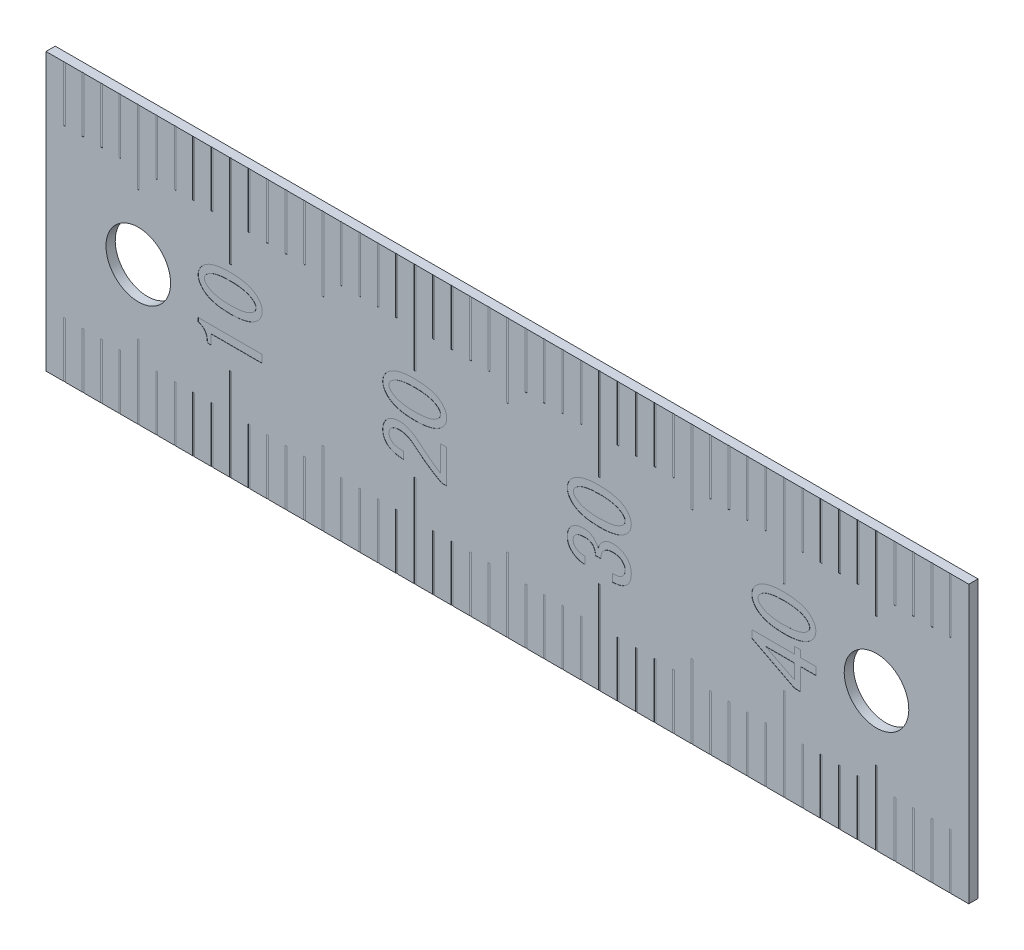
SolidWorks part; units mm, degrees
ref_plane "Front" through (0, 0, 0) normal (0, 0, 1) x (1, 0, 0)
ref_plane "Top" through (0, 0, 0) normal (0, 1, 0) x (1, 0, 0)
ref_plane "Right" through (0, 0, 0) normal (1, 0, 0) x (0, 0, -1)
sketch "Sketch1" plane through (0, 0, 0) normal (0, 0, 1) x (1, 0, 0)
  line L1 (0, 0) -> (0, 50)
  line L2 (0, 0) -> (15, 0)
  line L3 (15, 0) -> (15, 50)
  line L4 (0, 50) -> (15, 50)
  dimension "D1" = 50
  dimension "D2" = 15
extrude "Extrude1" add sketch "Sketch1" along normal blind 0.5
sketch "Sketch2" plane through (0, 0, 0.5) normal (0, 0, 1) x (1, 0, 0)
  line L0 (0, 50) -> (0, 0) construction
  line L1 (0, 0) -> (15, 0) construction
  line L2 (15, 50) -> (0, 50) construction
  circle A0 centre (7.5, 5) radius 1.75
  circle A1 centre (7.5, 45) radius 1.75
  dimension "D1" = 7.5
  dimension "D2" = 7.5
  dimension "D3" = 5
  dimension "D4" = 5
  dimension "D5" = 3.5
  dimension "D6" = 3.5
extrude "Extrude2" cut sketch "Sketch2" against normal through all
sketch "Sketch3" plane through (0, 0, 0.5) normal (0, 0, 1) x (1, 0, 0)
  line L0 (15, 50) -> (0, 50) construction
  line L1 (5.25, 28.25) -> (9.75, 28.25) construction
  line L2 (5.25, 18.25) -> (9.75, 18.25) construction
  line L3 (5.25, 8.25) -> (9.75, 8.25) construction
  line L5 (0, 50) -> (0, 0) construction
  line L7 (5.25, 38.25) -> (9.75, 38.25) construction
  line L8 (5.25, 38.25) -> (5.25, 41.75) construction
  line L9 (7.5, 0) -> (7.5, 50) construction
  line L10 (0, 0) -> (15, 0) construction
  line L11 (0, 40) -> (15, 40) construction
  line L12 (15, 0) -> (15, 50) construction
  line L13 (5.25, 41.75) -> (9.75, 41.75) construction
  line L14 (9.75, 38.25) -> (9.75, 41.75) construction
  line L15 (5.25, 38.25) -> (9.75, 41.75) construction
  line L16 (5.25, 41.75) -> (9.75, 38.25) construction
  circle A0 centre (7.5, 45) radius 1.75 construction
  text T0 "10" font "ＭＳ ゴシック" height 3.5
  text T1 "20" font "ＭＳ ゴシック" height 3.5
  text T2 "30" font "ＭＳ ゴシック" height 3.5
  text T3 "40" font "ＭＳ ゴシック" height 3.5
  point P7 (7.5, 40)
  dimension "D2" = 7.5
  dimension "D1" = 4
  dimension "D6" = 10
  dimension "D5" = 4.5
  dimension "D7" = 3.5
extrude "Extrude3" cut sketch "Sketch3" against normal blind 0.01
sketch "Sketch4" plane through (0, 0, 0.5) normal (0, 0, 1) x (1, 0, 0)
  line L0 (15, 40.05) -> (10, 40.05)
  line L1 (15, 0) -> (15, 50) construction
  line L2 (10, 40.05) -> (10, 39.95)
  line L3 (10, 39.95) -> (15, 39.95)
  line L4 (15, 39.95) -> (15, 40.05)
  line L5 (15, 50) -> (0, 50) construction
  line L6 (15, 48.05) -> (15, 47.95)
  line L7 (15, 44.95) -> (11, 44.95)
  line L8 (15, 44.95) -> (15, 45.05)
  line L9 (15, 45.05) -> (11, 45.05)
  line L10 (11, 44.95) -> (11, 45.05)
  line L11 (15, 49.05) -> (12, 49.05)
  line L12 (15, 49.05) -> (15, 48.95)
  line L13 (15, 48.95) -> (12, 48.95)
  line L14 (12, 49.05) -> (12, 48.95)
  line L15 (15, 48.05) -> (12, 48.05)
  line L16 (15, 47.95) -> (12, 47.95)
  line L17 (12, 48.05) -> (12, 47.95)
  line L18 (15, 47.05) -> (15, 46.95)
  line L19 (15, 47.05) -> (12, 47.05)
  line L20 (15, 46.95) -> (12, 46.95)
  line L21 (12, 47.05) -> (12, 46.95)
  line L22 (15, 46.05) -> (15, 45.95)
  line L23 (15, 46.05) -> (12, 46.05)
  line L24 (15, 45.95) -> (12, 45.95)
  line L25 (12, 46.05) -> (12, 45.95)
  line L26 (15, 30.05) -> (10, 30.05)
  line L27 (10, 30.05) -> (10, 29.95)
  line L28 (10, 29.95) -> (15, 29.95)
  line L29 (15, 29.95) -> (15, 30.05)
  line L30 (15, 44.05) -> (15, 43.95)
  line L31 (15, 44.05) -> (12, 44.05)
  line L32 (15, 43.95) -> (12, 43.95)
  line L33 (12, 44.05) -> (12, 43.95)
  line L34 (15, 43.05) -> (15, 42.95)
  line L35 (15, 43.05) -> (12, 43.05)
  line L36 (15, 42.95) -> (12, 42.95)
  line L37 (12, 43.05) -> (12, 42.95)
  line L38 (15, 42.05) -> (15, 41.95)
  line L39 (15, 42.05) -> (12, 42.05)
  line L40 (15, 41.95) -> (12, 41.95)
  line L41 (12, 42.05) -> (12, 41.95)
  line L42 (15, 41.05) -> (15, 40.95)
  line L43 (15, 41.05) -> (12, 41.05)
  line L44 (15, 40.95) -> (12, 40.95)
  line L45 (12, 41.05) -> (12, 40.95)
  line L46 (12, 45.05) -> (12, 44.95)
  line L47 (15, 45.05) -> (12, 45.05)
  line L48 (15, 44.95) -> (12, 44.95)
  line L49 (15, 45.05) -> (15, 44.95)
  line L50 (15, 38.05) -> (15, 37.95)
  line L51 (15, 34.95) -> (11, 34.95)
  line L52 (15, 34.95) -> (15, 35.05)
  line L53 (15, 35.05) -> (11, 35.05)
  line L54 (11, 34.95) -> (11, 35.05)
  line L55 (15, 39.05) -> (12, 39.05)
  line L56 (15, 39.05) -> (15, 38.95)
  line L57 (15, 38.95) -> (12, 38.95)
  line L58 (12, 39.05) -> (12, 38.95)
  line L59 (15, 38.05) -> (12, 38.05)
  line L60 (15, 37.95) -> (12, 37.95)
  line L61 (12, 38.05) -> (12, 37.95)
  line L62 (15, 37.05) -> (15, 36.95)
  line L63 (15, 37.05) -> (12, 37.05)
  line L64 (15, 36.95) -> (12, 36.95)
  line L65 (12, 37.05) -> (12, 36.95)
  line L66 (15, 36.05) -> (15, 35.95)
  line L67 (15, 36.05) -> (12, 36.05)
  line L68 (15, 35.95) -> (12, 35.95)
  line L69 (12, 36.05) -> (12, 35.95)
  line L70 (15, 34.05) -> (15, 33.95)
  line L71 (15, 34.05) -> (12, 34.05)
  line L72 (15, 33.95) -> (12, 33.95)
  line L73 (12, 34.05) -> (12, 33.95)
  line L74 (15, 33.05) -> (15, 32.95)
  line L75 (15, 33.05) -> (12, 33.05)
  line L76 (15, 32.95) -> (12, 32.95)
  line L77 (12, 33.05) -> (12, 32.95)
  line L78 (15, 32.05) -> (15, 31.95)
  line L79 (15, 32.05) -> (12, 32.05)
  line L80 (15, 31.95) -> (12, 31.95)
  line L81 (12, 32.05) -> (12, 31.95)
  line L82 (15, 31.05) -> (15, 30.95)
  line L83 (15, 31.05) -> (12, 31.05)
  line L84 (15, 30.95) -> (12, 30.95)
  line L85 (12, 31.05) -> (12, 30.95)
  line L86 (15, 20.05) -> (10, 20.05)
  line L87 (10, 20.05) -> (10, 19.95)
  line L88 (10, 19.95) -> (15, 19.95)
  line L89 (15, 19.95) -> (15, 20.05)
  line L90 (15, 28.05) -> (15, 27.95)
  line L91 (15, 24.95) -> (11, 24.95)
  line L92 (15, 24.95) -> (15, 25.05)
  line L93 (15, 25.05) -> (11, 25.05)
  line L94 (11, 24.95) -> (11, 25.05)
  line L95 (15, 29.05) -> (12, 29.05)
  line L96 (15, 29.05) -> (15, 28.95)
  line L97 (15, 28.95) -> (12, 28.95)
  line L98 (12, 29.05) -> (12, 28.95)
  line L99 (15, 28.05) -> (12, 28.05)
  line L100 (15, 27.95) -> (12, 27.95)
  line L101 (12, 28.05) -> (12, 27.95)
  line L102 (15, 27.05) -> (15, 26.95)
  line L103 (15, 27.05) -> (12, 27.05)
  line L104 (15, 26.95) -> (12, 26.95)
  line L105 (12, 27.05) -> (12, 26.95)
  line L106 (15, 26.05) -> (15, 25.95)
  line L107 (15, 26.05) -> (12, 26.05)
  line L108 (15, 25.95) -> (12, 25.95)
  line L109 (12, 26.05) -> (12, 25.95)
  line L110 (15, 24.05) -> (15, 23.95)
  line L111 (15, 24.05) -> (12, 24.05)
  line L112 (15, 23.95) -> (12, 23.95)
  line L113 (12, 24.05) -> (12, 23.95)
  line L114 (15, 23.05) -> (15, 22.95)
  line L115 (15, 23.05) -> (12, 23.05)
  line L116 (15, 22.95) -> (12, 22.95)
  line L117 (12, 23.05) -> (12, 22.95)
  line L118 (15, 22.05) -> (15, 21.95)
  line L119 (15, 22.05) -> (12, 22.05)
  line L120 (15, 21.95) -> (12, 21.95)
  line L121 (12, 22.05) -> (12, 21.95)
  line L122 (15, 21.05) -> (15, 20.95)
  line L123 (15, 21.05) -> (12, 21.05)
  line L124 (15, 20.95) -> (12, 20.95)
  line L125 (12, 21.05) -> (12, 20.95)
  line L126 (15, 10.05) -> (10, 10.05)
  line L127 (10, 10.05) -> (10, 9.95)
  line L128 (10, 9.95) -> (15, 9.95)
  line L129 (15, 9.95) -> (15, 10.05)
  line L130 (15, 18.05) -> (15, 17.95)
  line L131 (15, 14.95) -> (11, 14.95)
  line L132 (15, 14.95) -> (15, 15.05)
  line L133 (15, 15.05) -> (11, 15.05)
  line L134 (11, 14.95) -> (11, 15.05)
  line L135 (15, 19.05) -> (12, 19.05)
  line L136 (15, 19.05) -> (15, 18.95)
  line L137 (15, 18.95) -> (12, 18.95)
  line L138 (12, 19.05) -> (12, 18.95)
  line L139 (15, 18.05) -> (12, 18.05)
  line L140 (15, 17.95) -> (12, 17.95)
  line L141 (12, 18.05) -> (12, 17.95)
  line L142 (15, 17.05) -> (15, 16.95)
  line L143 (15, 17.05) -> (12, 17.05)
  line L144 (15, 16.95) -> (12, 16.95)
  line L145 (12, 17.05) -> (12, 16.95)
  line L146 (15, 16.05) -> (15, 15.95)
  line L147 (15, 16.05) -> (12, 16.05)
  line L148 (15, 15.95) -> (12, 15.95)
  line L149 (12, 16.05) -> (12, 15.95)
  line L150 (15, 14.05) -> (15, 13.95)
  line L151 (15, 14.05) -> (12, 14.05)
  line L152 (15, 13.95) -> (12, 13.95)
  line L153 (12, 14.05) -> (12, 13.95)
  line L154 (15, 13.05) -> (15, 12.95)
  line L155 (15, 13.05) -> (12, 13.05)
  line L156 (15, 12.95) -> (12, 12.95)
  line L157 (12, 13.05) -> (12, 12.95)
  line L158 (15, 12.05) -> (15, 11.95)
  line L159 (15, 12.05) -> (12, 12.05)
  line L160 (15, 11.95) -> (12, 11.95)
  line L161 (12, 12.05) -> (12, 11.95)
  line L162 (15, 11.05) -> (15, 10.95)
  line L163 (15, 11.05) -> (12, 11.05)
  line L164 (15, 10.95) -> (12, 10.95)
  line L165 (12, 11.05) -> (12, 10.95)
  line L166 (7.5, 50) -> (7.5, 36.693) construction
  line L167 (3, 1.05) -> (3, 0.95)
  line L168 (0, 0.95) -> (3, 0.95)
  line L169 (0, 1.05) -> (3, 1.05)
  line L170 (15, 8.05) -> (15, 7.95)
  line L171 (15, 4.95) -> (11, 4.95)
  line L172 (15, 4.95) -> (15, 5.05)
  line L173 (15, 5.05) -> (11, 5.05)
  line L174 (11, 4.95) -> (11, 5.05)
  line L175 (15, 9.05) -> (12, 9.05)
  line L176 (15, 9.05) -> (15, 8.95)
  line L177 (15, 8.95) -> (12, 8.95)
  line L178 (12, 9.05) -> (12, 8.95)
  line L179 (15, 8.05) -> (12, 8.05)
  line L180 (15, 7.95) -> (12, 7.95)
  line L181 (12, 8.05) -> (12, 7.95)
  line L182 (15, 7.05) -> (15, 6.95)
  line L183 (15, 7.05) -> (12, 7.05)
  line L184 (15, 6.95) -> (12, 6.95)
  line L185 (12, 7.05) -> (12, 6.95)
  line L186 (15, 6.05) -> (15, 5.95)
  line L187 (15, 6.05) -> (12, 6.05)
  line L188 (15, 5.95) -> (12, 5.95)
  line L189 (12, 6.05) -> (12, 5.95)
  line L190 (15, 4.05) -> (15, 3.95)
  line L191 (15, 4.05) -> (12, 4.05)
  line L192 (15, 3.95) -> (12, 3.95)
  line L193 (12, 4.05) -> (12, 3.95)
  line L194 (15, 3.05) -> (15, 2.95)
  line L195 (15, 3.05) -> (12, 3.05)
  line L196 (15, 2.95) -> (12, 2.95)
  line L197 (12, 3.05) -> (12, 2.95)
  line L198 (15, 2.05) -> (15, 1.95)
  line L199 (15, 2.05) -> (12, 2.05)
  line L200 (15, 1.95) -> (12, 1.95)
  line L201 (12, 2.05) -> (12, 1.95)
  line L202 (15, 1.05) -> (15, 0.95)
  line L203 (15, 1.05) -> (12, 1.05)
  line L204 (15, 0.95) -> (12, 0.95)
  line L205 (12, 1.05) -> (12, 0.95)
  line L206 (15, 0.05) -> (10, 0.05)
  line L207 (10, 0.05) -> (10, -0.05)
  line L208 (10, -0.05) -> (15, -0.05)
  line L209 (15, -0.05) -> (15, 0.05)
  line L210 (0, 1.05) -> (0, 0.95)
  line L211 (3, 2.05) -> (3, 1.95)
  line L212 (0, 1.95) -> (3, 1.95)
  line L213 (0, 2.05) -> (3, 2.05)
  line L214 (0, 2.05) -> (0, 1.95)
  line L215 (3, 3.05) -> (3, 2.95)
  line L216 (0, 2.95) -> (3, 2.95)
  line L217 (0, 3.05) -> (3, 3.05)
  line L218 (0, 3.05) -> (0, 2.95)
  line L219 (3, 4.05) -> (3, 3.95)
  line L220 (0, 3.95) -> (3, 3.95)
  line L221 (0, 4.05) -> (3, 4.05)
  line L222 (0, 4.05) -> (0, 3.95)
  line L223 (3, 6.05) -> (3, 5.95)
  line L224 (0, 5.95) -> (3, 5.95)
  line L225 (0, 6.05) -> (3, 6.05)
  line L226 (0, 6.05) -> (0, 5.95)
  line L227 (3, 7.05) -> (3, 6.95)
  line L228 (0, 6.95) -> (3, 6.95)
  line L229 (0, 7.05) -> (3, 7.05)
  line L230 (0, 7.05) -> (0, 6.95)
  line L231 (3, 8.05) -> (3, 7.95)
  line L232 (0, 7.95) -> (3, 7.95)
  line L233 (0, 8.05) -> (3, 8.05)
  line L234 (3, 9.05) -> (3, 8.95)
  line L235 (0, 8.95) -> (3, 8.95)
  line L236 (0, 9.05) -> (0, 8.95)
  line L237 (0, 9.05) -> (3, 9.05)
  line L238 (4, 4.95) -> (4, 5.05)
  line L239 (0, 5.05) -> (4, 5.05)
  line L240 (0, 4.95) -> (0, 5.05)
  line L241 (0, 4.95) -> (4, 4.95)
  line L242 (0, 8.05) -> (0, 7.95)
  line L243 (3, 11.05) -> (3, 10.95)
  line L244 (0, 10.95) -> (3, 10.95)
  line L245 (0, 11.05) -> (3, 11.05)
  line L246 (0, 11.05) -> (0, 10.95)
  line L247 (3, 12.05) -> (3, 11.95)
  line L248 (0, 11.95) -> (3, 11.95)
  line L249 (0, 12.05) -> (3, 12.05)
  line L250 (0, 12.05) -> (0, 11.95)
  line L251 (3, 13.05) -> (3, 12.95)
  line L252 (0, 12.95) -> (3, 12.95)
  line L253 (0, 13.05) -> (3, 13.05)
  line L254 (0, 13.05) -> (0, 12.95)
  line L255 (3, 14.05) -> (3, 13.95)
  line L256 (0, 13.95) -> (3, 13.95)
  line L257 (0, 14.05) -> (3, 14.05)
  line L258 (0, 14.05) -> (0, 13.95)
  line L259 (3, 16.05) -> (3, 15.95)
  line L260 (0, 15.95) -> (3, 15.95)
  line L261 (0, 16.05) -> (3, 16.05)
  line L262 (0, 16.05) -> (0, 15.95)
  line L263 (3, 17.05) -> (3, 16.95)
  line L264 (0, 16.95) -> (3, 16.95)
  line L265 (0, 17.05) -> (3, 17.05)
  line L266 (0, 17.05) -> (0, 16.95)
  line L267 (3, 18.05) -> (3, 17.95)
  line L268 (0, 17.95) -> (3, 17.95)
  line L269 (0, 18.05) -> (3, 18.05)
  line L270 (3, 19.05) -> (3, 18.95)
  line L271 (0, 18.95) -> (3, 18.95)
  line L272 (0, 19.05) -> (0, 18.95)
  line L273 (0, 19.05) -> (3, 19.05)
  line L274 (4, 14.95) -> (4, 15.05)
  line L275 (0, 15.05) -> (4, 15.05)
  line L276 (0, 14.95) -> (0, 15.05)
  line L277 (0, 14.95) -> (4, 14.95)
  line L278 (0, 18.05) -> (0, 17.95)
  line L279 (0, 9.95) -> (0, 10.05)
  line L280 (5, 9.95) -> (0, 9.95)
  line L281 (5, 10.05) -> (5, 9.95)
  line L282 (0, 10.05) -> (5, 10.05)
  line L283 (3, 21.05) -> (3, 20.95)
  line L284 (0, 20.95) -> (3, 20.95)
  line L285 (0, 21.05) -> (3, 21.05)
  line L286 (0, 21.05) -> (0, 20.95)
  line L287 (3, 22.05) -> (3, 21.95)
  line L288 (0, 21.95) -> (3, 21.95)
  line L289 (0, 22.05) -> (3, 22.05)
  line L290 (0, 22.05) -> (0, 21.95)
  line L291 (3, 23.05) -> (3, 22.95)
  line L292 (0, 22.95) -> (3, 22.95)
  line L293 (0, 23.05) -> (3, 23.05)
  line L294 (0, 23.05) -> (0, 22.95)
  line L295 (3, 24.05) -> (3, 23.95)
  line L296 (0, 23.95) -> (3, 23.95)
  line L297 (0, 24.05) -> (3, 24.05)
  line L298 (0, 24.05) -> (0, 23.95)
  line L299 (3, 26.05) -> (3, 25.95)
  line L300 (0, 25.95) -> (3, 25.95)
  line L301 (0, 26.05) -> (3, 26.05)
  line L302 (0, 26.05) -> (0, 25.95)
  line L303 (3, 27.05) -> (3, 26.95)
  line L304 (0, 26.95) -> (3, 26.95)
  line L305 (0, 27.05) -> (3, 27.05)
  line L306 (0, 27.05) -> (0, 26.95)
  line L307 (3, 28.05) -> (3, 27.95)
  line L308 (0, 27.95) -> (3, 27.95)
  line L309 (0, 28.05) -> (3, 28.05)
  line L310 (3, 29.05) -> (3, 28.95)
  line L311 (0, 28.95) -> (3, 28.95)
  line L312 (0, 29.05) -> (0, 28.95)
  line L313 (0, 29.05) -> (3, 29.05)
  line L314 (4, 24.95) -> (4, 25.05)
  line L315 (0, 25.05) -> (4, 25.05)
  line L316 (0, 24.95) -> (0, 25.05)
  line L317 (0, 24.95) -> (4, 24.95)
  line L318 (0, 28.05) -> (0, 27.95)
  line L319 (0, 19.95) -> (0, 20.05)
  line L320 (5, 19.95) -> (0, 19.95)
  line L321 (5, 20.05) -> (5, 19.95)
  line L322 (0, 20.05) -> (5, 20.05)
  line L323 (3, 31.05) -> (3, 30.95)
  line L324 (0, 30.95) -> (3, 30.95)
  line L325 (0, 31.05) -> (3, 31.05)
  line L326 (0, 31.05) -> (0, 30.95)
  line L327 (3, 32.05) -> (3, 31.95)
  line L328 (0, 31.95) -> (3, 31.95)
  line L329 (0, 32.05) -> (3, 32.05)
  line L330 (0, 32.05) -> (0, 31.95)
  line L331 (3, 33.05) -> (3, 32.95)
  line L332 (0, 32.95) -> (3, 32.95)
  line L333 (0, 33.05) -> (3, 33.05)
  line L334 (0, 33.05) -> (0, 32.95)
  line L335 (3, 34.05) -> (3, 33.95)
  line L336 (0, 33.95) -> (3, 33.95)
  line L337 (0, 34.05) -> (3, 34.05)
  line L338 (0, 34.05) -> (0, 33.95)
  line L339 (3, 36.05) -> (3, 35.95)
  line L340 (0, 35.95) -> (3, 35.95)
  line L341 (0, 36.05) -> (3, 36.05)
  line L342 (0, 36.05) -> (0, 35.95)
  line L343 (3, 37.05) -> (3, 36.95)
  line L344 (0, 36.95) -> (3, 36.95)
  line L345 (0, 37.05) -> (3, 37.05)
  line L346 (0, 37.05) -> (0, 36.95)
  line L347 (3, 38.05) -> (3, 37.95)
  line L348 (0, 37.95) -> (3, 37.95)
  line L349 (0, 38.05) -> (3, 38.05)
  line L350 (3, 39.05) -> (3, 38.95)
  line L351 (0, 38.95) -> (3, 38.95)
  line L352 (0, 39.05) -> (0, 38.95)
  line L353 (0, 39.05) -> (3, 39.05)
  line L354 (4, 34.95) -> (4, 35.05)
  line L355 (0, 35.05) -> (4, 35.05)
  line L356 (0, 34.95) -> (0, 35.05)
  line L357 (0, 34.95) -> (4, 34.95)
  line L358 (0, 38.05) -> (0, 37.95)
  line L359 (3, 41.05) -> (3, 40.95)
  line L360 (0, 40.95) -> (3, 40.95)
  line L361 (0, 41.05) -> (3, 41.05)
  line L362 (0, 41.05) -> (0, 40.95)
  line L363 (3, 42.05) -> (3, 41.95)
  line L364 (0, 41.95) -> (3, 41.95)
  line L365 (0, 42.05) -> (3, 42.05)
  line L366 (0, 42.05) -> (0, 41.95)
  line L367 (3, 43.05) -> (3, 42.95)
  line L368 (0, 42.95) -> (3, 42.95)
  line L369 (0, 43.05) -> (3, 43.05)
  line L370 (0, 43.05) -> (0, 42.95)
  line L371 (3, 44.05) -> (3, 43.95)
  line L372 (0, 43.95) -> (3, 43.95)
  line L373 (0, 44.05) -> (3, 44.05)
  line L374 (0, 44.05) -> (0, 43.95)
  line L375 (0, 29.95) -> (0, 30.05)
  line L376 (5, 29.95) -> (0, 29.95)
  line L377 (5, 30.05) -> (5, 29.95)
  line L378 (0, 30.05) -> (5, 30.05)
  line L379 (3, 46.05) -> (3, 45.95)
  line L380 (0, 45.95) -> (3, 45.95)
  line L381 (0, 46.05) -> (3, 46.05)
  line L382 (0, 46.05) -> (0, 45.95)
  line L383 (3, 47.05) -> (3, 46.95)
  line L384 (0, 46.95) -> (3, 46.95)
  line L385 (0, 47.05) -> (3, 47.05)
  line L386 (0, 47.05) -> (0, 46.95)
  line L387 (3, 48.05) -> (3, 47.95)
  line L388 (0, 47.95) -> (3, 47.95)
  line L389 (0, 48.05) -> (3, 48.05)
  line L390 (3, 49.05) -> (3, 48.95)
  line L391 (0, 48.95) -> (3, 48.95)
  line L392 (0, 49.05) -> (0, 48.95)
  line L393 (0, 49.05) -> (3, 49.05)
  line L394 (4, 44.95) -> (4, 45.05)
  line L395 (0, 45.05) -> (4, 45.05)
  line L396 (0, 44.95) -> (0, 45.05)
  line L397 (0, 44.95) -> (4, 44.95)
  line L398 (0, 48.05) -> (0, 47.95)
  line L399 (0, 39.95) -> (0, 40.05)
  line L400 (5, 39.95) -> (0, 39.95)
  line L401 (5, 40.05) -> (5, 39.95)
  line L402 (0, 40.05) -> (5, 40.05)
  point P4 (15, 40)
  point P13 (15, 45)
  point P18 (15, 49)
  dimension "D1" = 10
  dimension "D2" = 0.1
  dimension "D3" = 5
  dimension "D4" = 5
  dimension "D5" = 0.1
  dimension "D6" = 1
  dimension "D7" = 0.1
  dimension "D8" = 3
  dimension "D9" = 4
  dimension "D10" = 9
  dimension "D11" = 5
extrude "Extrude4" cut sketch "Sketch4" against normal blind 0.01
move or copy body "Body-Move/Copy2" bodies to move or copy 105 copy no rotation origin (0, 0, 0) rotation axis (0, 0, 1) rotation angle 90
move or copy body "Body-Move/Copy3" bodies to move or copy 107 copy no translate (50, -7.5, 0)
